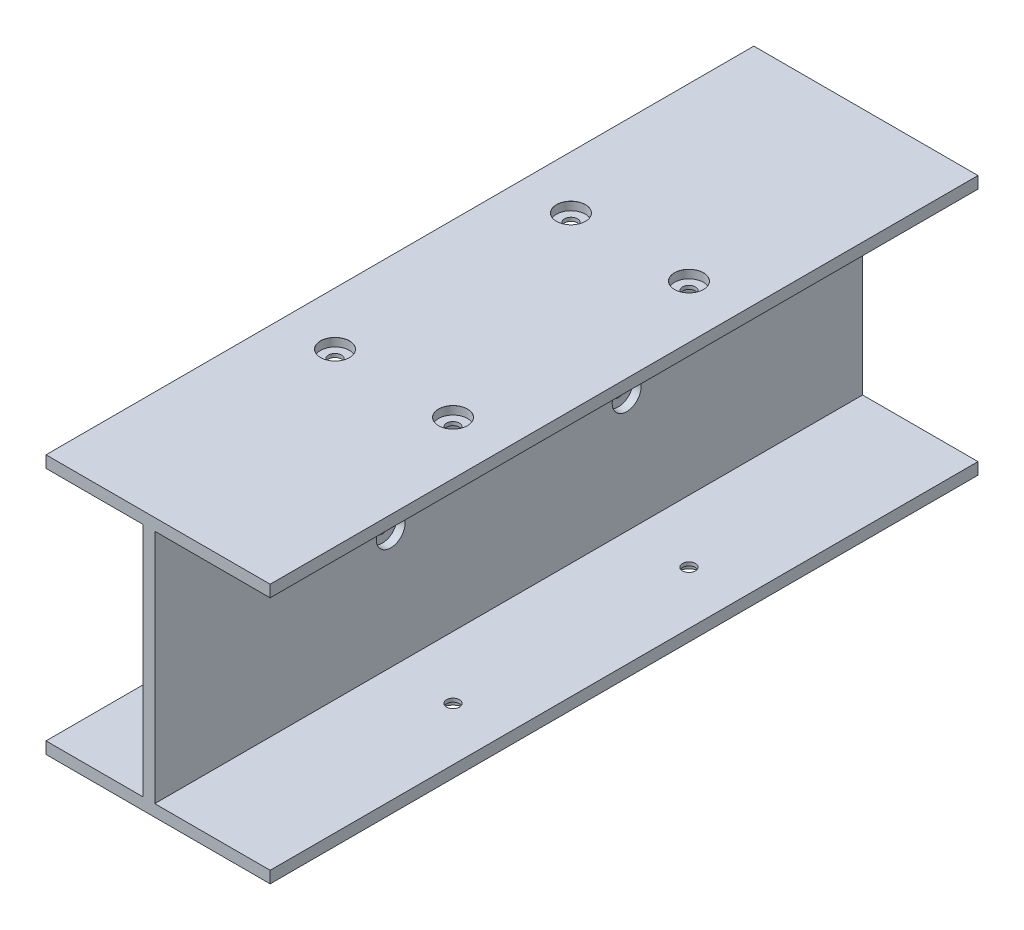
SolidWorks part; units mm, degrees
ref_plane "Front Plane" through (0, 0, 0) normal (0, 0, 1) x (1, 0, 0)
ref_plane "Top Plane" through (0, 0, 0) normal (0, 1, 0) x (1, 0, 0)
ref_plane "Right Plane" through (0, 0, 0) normal (1, 0, 0) x (0, 0, -1)
sketch "Sketch1" plane through (0, 0, 0) normal (0, 0, 1) x (1, 0, 0)
  line L1 (-47.5, -55) -> (47.5, -55)
  line L2 (-47.5, -55) -> (-47.5, -50)
  line L3 (-47.5, 55) -> (47.5, 55)
  line L4 (47.5, -55) -> (47.5, -50)
  line L5 (-47.5, -55) -> (47.5, 55) construction
  line L6 (-47.5, 55) -> (47.5, -55) construction
  line L7 (-6.4074, 50) -> (-6.4074, -50)
  line L8 (-1.4074, 50) -> (-1.4074, 1.6297)
  line L9 (-47.5, 50) -> (-6.4074, 50)
  line L10 (-47.5, -50) -> (-6.4074, -50)
  line L11 (-1.4074, 56.6297) -> (-1.4074, -43.3703) construction
  line L12 (-6.4074, 56.6297) -> (-6.4074, -43.3703) construction
  line L13 (-47.5, 50) -> (-47.5, 55)
  line L14 (47.5, 50) -> (47.5, 55)
  line L15 (-1.4074, 1.6297) -> (-1.4074, -50)
  line L16 (-1.4074, -50) -> (47.5, -50)
  line L17 (-1.4074, 50) -> (47.5, 50)
  point P0 (0, 0)
  dimension "D1" = 95
  dimension "D2" = 110
  dimension "D5" = 5
  dimension "D6" = 5
  dimension "D4" = 5
extrude "Boss-Extrude1" add sketch "Sketch1" along normal blind 300
sketch "Sketch2" plane through (0, 55, 0) normal (0, 1, 0) x (1, 0, 0)
  line L1 (47.5, -300) -> (47.5, 0) construction
  line L2 (47.5, -300) -> (-47.5, -300) construction
  point P0 (25, -200)
  point P1 (25, -200)
  dimension "D1" = 22.5
  dimension "D2" = 100
hole_wizard "CBORE for M5 Hex Head Bolt1" positions "Sketch3" profile "Sketch4" counterbore size "M5" standard "ISO"
sketch "Sketch3" plane through (0, 55, 0) normal (0, 1, 0) x (1, 0, 0)
  point P0 (25, -200)
sketch "Sketch4" plane through (25, 55, 200) normal (1, 0, 0) x (0, 0, 1)
  line L0 (0, 0) -> (0, 11.7024)
  line L1 (0, 11.7024) -> (2.75, 10.05)
  line L2 (2.75, 10.05) -> (2.75, 3.5)
  line L3 (2.75, 3.5) -> (6.119, 3.5)
  line L5 (6.119, 3.5) -> (6.119, 0.025)
  line L6 (6.119, 0.025) -> (6.144, 0)
  line L7 (6.144, 0) -> (0, 0)
  line L8 (-6.119, 0.025) -> (-6.144, 0) construction
  line L10 (0, 11.7024) -> (-2.75, 10.05) construction
  line L11 (0, -6.35) -> (0, 107.95) construction
  dimension "Hole Dia." = 5.5
  dimension "Hole Depth" = 10.05
  dimension "C'Bore Dia." = 12.238
  dimension "C'Bore Depth" = 3.5
  dimension "Near C'Sink Dia." = 12.288
  dimension "Near C'Sink Angle" = 90
  dimension "Drill Angle" = 118
pattern_linear "LPattern1" count 2 spacing 100 along (0, 0, -1) of "CBORE for M5 Hex Head Bolt1"
hole_wizard "CBORE for M5 Hex Head Bolt2" positions "Sketch5" profile "Sketch6" counterbore size "M5" standard "ISO"
sketch "Sketch5" plane through (0, -55, 0) normal (0, -1, 0) x (-1, 0, 0)
  point P0 (-25, -200)
sketch "Sketch6" plane through (25, -55, 200) normal (1, 0, 0) x (0, 0, -1)
  line L0 (0, 0) -> (0, 11.7024)
  line L1 (0, 11.7024) -> (2.75, 10.05)
  line L2 (2.75, 10.05) -> (2.75, 3.5)
  line L3 (2.75, 3.5) -> (6.119, 3.5)
  line L5 (6.119, 3.5) -> (6.119, 0.025)
  line L6 (6.119, 0.025) -> (6.144, 0)
  line L7 (6.144, 0) -> (0, 0)
  line L8 (-6.119, 0.025) -> (-6.144, 0) construction
  line L10 (0, 11.7024) -> (-2.75, 10.05) construction
  line L11 (0, -6.35) -> (0, 107.95) construction
  dimension "Hole Dia." = 5.5
  dimension "Hole Depth" = 10.05
  dimension "C'Bore Dia." = 12.238
  dimension "C'Bore Depth" = 3.5
  dimension "Near C'Sink Dia." = 12.288
  dimension "Near C'Sink Angle" = 90
  dimension "Drill Angle" = 118
pattern_linear "LPattern2" count 2 spacing 100 along (0, 0, -1) of "CBORE for M5 Hex Head Bolt2"
sketch "Sketch8" plane through (0, 55, 0) normal (0, 1, 0) x (1, 0, 0)
  line L0 (-47.5, -300) -> (-47.5, 0) construction
  line L1 (47.5, -300) -> (-47.5, -300) construction
  point P0 (-25, -200)
  dimension "D1" = 22.5
  dimension "D2" = 100
hole_wizard "CBORE for M5 Hex Head Bolt3" positions "Sketch9" profile "Sketch10" counterbore size "M5" standard "ISO"
sketch "Sketch9" plane through (0, 55, 0) normal (0, 1, 0) x (1, 0, 0)
  point P0 (-25, -200)
sketch "Sketch10" plane through (-25, 55, 200) normal (1, 0, 0) x (0, 0, 1)
  line L0 (0, 0) -> (0, 11.7024)
  line L1 (0, 11.7024) -> (2.75, 10.05)
  line L2 (2.75, 10.05) -> (2.75, 3.5)
  line L3 (2.75, 3.5) -> (6.119, 3.5)
  line L5 (6.119, 3.5) -> (6.119, 0.025)
  line L6 (6.119, 0.025) -> (6.144, 0)
  line L7 (6.144, 0) -> (0, 0)
  line L8 (-6.119, 0.025) -> (-6.144, 0) construction
  line L10 (0, 11.7024) -> (-2.75, 10.05) construction
  line L11 (0, -6.35) -> (0, 107.95) construction
  dimension "Hole Dia." = 5.5
  dimension "Hole Depth" = 10.05
  dimension "C'Bore Dia." = 12.238
  dimension "C'Bore Depth" = 3.5
  dimension "Near C'Sink Dia." = 12.288
  dimension "Near C'Sink Angle" = 90
  dimension "Drill Angle" = 118
pattern_linear "LPattern3" count 2 spacing 100 along (0, 0, -1) of "CBORE for M5 Hex Head Bolt3"
hole_wizard "CBORE for M5 Hex Head Bolt4" positions "Sketch12" profile "Sketch13" counterbore size "M5" standard "ISO"
sketch "Sketch12" plane through (0, -55, 0) normal (0, -1, 0) x (-1, 0, 0)
  point P0 (25, -200)
sketch "Sketch13" plane through (-25, -55, 200) normal (1, 0, 0) x (0, 0, -1)
  line L0 (0, 0) -> (0, 11.7024)
  line L1 (0, 11.7024) -> (2.75, 10.05)
  line L2 (2.75, 10.05) -> (2.75, 3.5)
  line L3 (2.75, 3.5) -> (6.119, 3.5)
  line L5 (6.119, 3.5) -> (6.119, 0.025)
  line L6 (6.119, 0.025) -> (6.144, 0)
  line L7 (6.144, 0) -> (0, 0)
  line L8 (-6.119, 0.025) -> (-6.144, 0) construction
  line L10 (0, 11.7024) -> (-2.75, 10.05) construction
  line L11 (0, -6.35) -> (0, 107.95) construction
  dimension "Hole Dia." = 5.5
  dimension "Hole Depth" = 10.05
  dimension "C'Bore Dia." = 12.238
  dimension "C'Bore Depth" = 3.5
  dimension "Near C'Sink Dia." = 12.288
  dimension "Near C'Sink Angle" = 90
  dimension "Drill Angle" = 118
pattern_linear "LPattern4" count 2 spacing 100 along (0, 0, -1) of "CBORE for M5 Hex Head Bolt4"
sketch "Sketch14" plane through (-1.4074, 0, 0) normal (1, 0, 0) x (0, 0, -1)
  line L0 (-300, -50) -> (-300, 50) construction
  line L2 (-300, 50) -> (0, 50) construction
  point P0 (-200, 0)
  dimension "D1" = 100
  dimension "D2" = 50
hole_wizard "CBORE for M5 Hex Head Bolt5" positions "Sketch19" profile "Sketch20" counterbore size "M5" standard "ISO"
sketch "Sketch19" plane through (-1.4074, 0, 0) normal (1, 0, 0) x (0, 0, -1)
  point P0 (-200, 0)
sketch "Sketch20" plane through (-1.4074, 0, 200) normal (0, 1, 0) x (0, 0, -1)
  line L0 (0, 0) -> (0, 11.7024)
  line L1 (0, 11.7024) -> (2.75, 10.05)
  line L2 (2.75, 10.05) -> (2.75, 3.5)
  line L3 (2.75, 3.5) -> (6.119, 3.5)
  line L4 (6.119, 3.5) -> (6.119, 0)
  line L5 (6.119, 0) -> (0, 0)
  line L10 (0, 11.7024) -> (-2.75, 10.05) construction
  line L11 (0, -6.35) -> (0, 107.95) construction
  dimension "Hole Dia." = 5.5
  dimension "Hole Depth" = 10.05
  dimension "C'Bore Dia." = 12.238
  dimension "C'Bore Depth" = 3.5
  dimension "Drill Angle" = 118
pattern_linear "LPattern5" count 2 spacing 100 along (0, 0, -1) of "CBORE for M5 Hex Head Bolt5"
